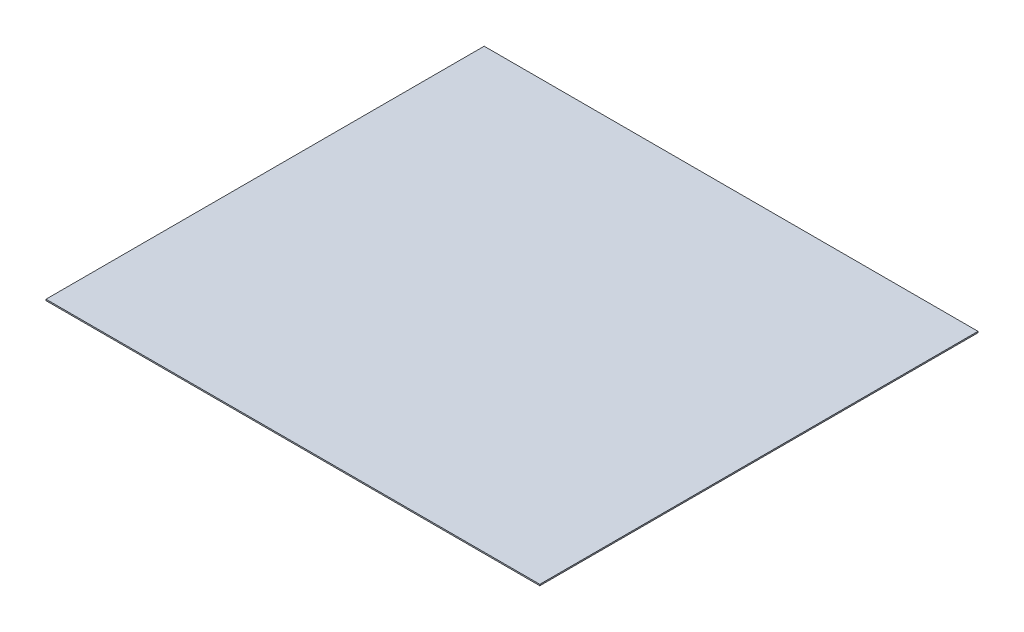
SolidWorks part; units mm, degrees
ref_plane "FRONT" through (0, 0, 0) normal (0, 0, 1) x (1, 0, 0)
ref_plane "TOP" through (0, 0, 0) normal (0, 1, 0) x (1, 0, 0)
ref_plane "RIGHT" through (0, 0, 0) normal (1, 0, 0) x (0, 0, -1)
sketch "Sketch1" plane through (0, 0, 0) normal (0, 1, 0) x (1, 0, 0)
  line L1 (-901.7, 800.1) -> (901.7, 800.1)
  line L2 (-901.7, 800.1) -> (-901.7, -800.1)
  line L3 (-901.7, -800.1) -> (901.7, -800.1)
  line L4 (901.7, 800.1) -> (901.7, -800.1)
  line L5 (-901.7, 800.1) -> (901.7, -800.1) construction
  line L6 (-901.7, -800.1) -> (901.7, 800.1) construction
  point P0 (0, 0)
  dimension "D1" = 1803.4
  dimension "D2" = 1600.2
extrude "Boss-Extrude1" add sketch "Sketch1" along normal blind 4.7625
